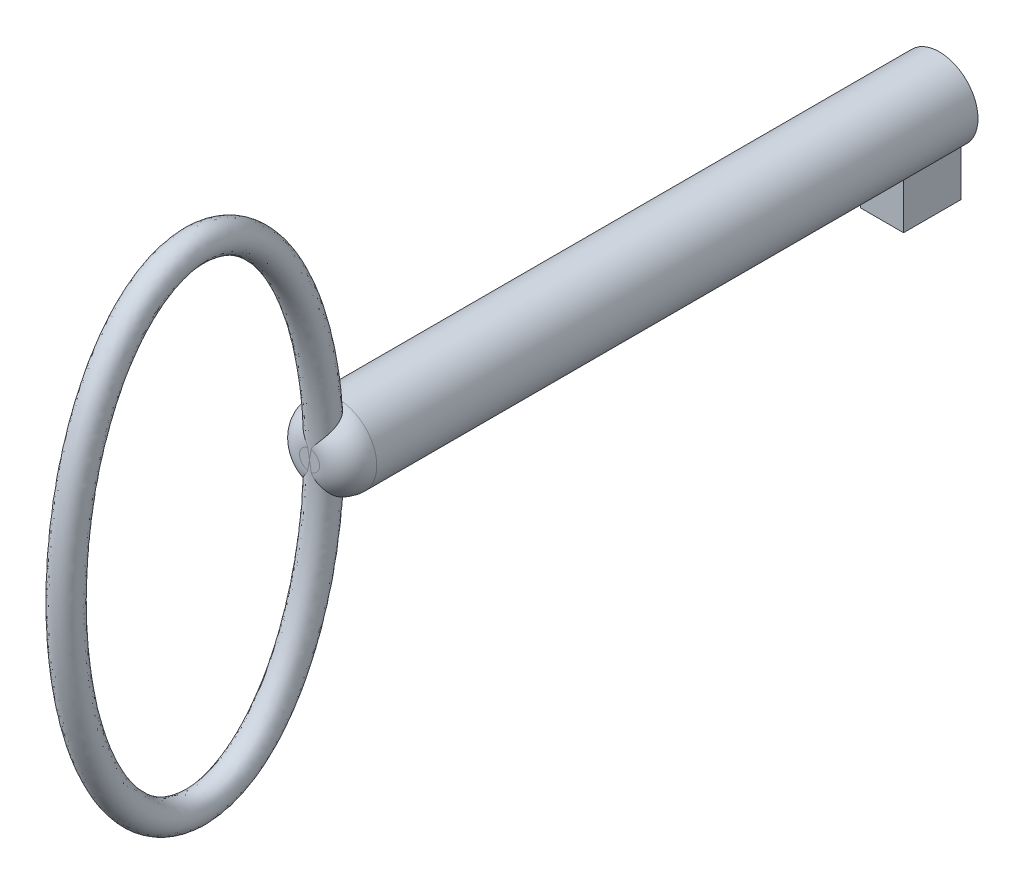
SolidWorks part; units mm, degrees
ref_plane "Front Plane" through (0, 0, 0) normal (0, 0, 1) x (1, 0, 0)
ref_plane "Top Plane" through (0, 0, 0) normal (0, 1, 0) x (1, 0, 0)
ref_plane "Right Plane" through (0, 0, 0) normal (1, 0, 0) x (0, 0, -1)
sketch "Sketch1" plane through (0, 0, 0) normal (0, 0, 1) x (1, 0, 0)
  line L0 (0, 0) -> (0, 12.8907) construction
  line L2 (1.5875, -1.9828) -> (1.5875, -4.7625)
  line L3 (1.5875, -4.7625) -> (-1.5875, -4.7625)
  line L4 (-1.5875, -1.9828) -> (-1.5875, -4.7625)
  arc A0 (1.5875, -1.9828) -> (-1.5875, -1.9828) centre (0, 0) ccw
  point P11 (0, -4.7625)
  dimension "D1" = 2.54
  dimension "D3" = 3.175
  dimension "D4" = 4.7625
sketch "Sketch2" plane through (0, 0, 0) normal (0, 0, 1) x (1, 0, 0)
  line L6 (1.1906, -4.3656) -> (1.1906, -1.782)
  line L7 (-1.1906, -4.3656) -> (1.1906, -4.3656)
  line L8 (-1.1906, -1.782) -> (-1.1906, -4.3656)
  line L9 (1.1906, -4.3656) -> (1.1906, -1.782)
  line L10 (-1.1906, -4.3656) -> (1.1906, -4.3656)
  line L11 (-1.1906, -1.782) -> (-1.1906, -4.3656)
  arc A2 (1.1906, -1.782) -> (-1.1906, -1.782) centre (0, 0) ccw
  arc A3 (1.1906, -1.782) -> (-1.1906, -1.782) centre (0, 0) ccw
  dimension "D1" = 0.3969
extrude "Extrude1" add sketch "Sketch2" along normal blind 3.175
sketch "Sketch3" plane through (0, 0, 3.175) normal (0, 0, 1) x (1, 0, 0)
  circle A0 centre (0, 0) radius 2.1431
  arc A1 (1.1906, -1.782) -> (-1.1906, -1.782) centre (0, 0) ccw construction
extrude "Extrude2" add sketch "Sketch3" along normal blind 31.75
sketch "Sketch4" plane through (0, 0, 0) normal (1, 0, 0) x (0, 0, -1)
  line L0 (-3.175, 0) -> (0, 0) construction
  line L1 (-34.925, 2.1431) -> (-34.925, -2.1431) construction
  ellipse E0 centre (-41.275, 0) end of major axis (-41.275, 12.7) minor radius 6.35
  dimension "D1" = 25.4
  dimension "D2" = 12.7
fillet "Fillet4" radius 1.5875 1 edges at (2.1431, 0, 34.925)
sketch "Sketch5" plane through (0, 0, 0) normal (0, 1, 0) x (1, 0, 0)
  line L2 (0, -33.3375) -> (0, 0) construction
  circle A0 centre (0, -34.1312) radius 0.7937
  dimension "D1" = 1.5875
sweep "Sweep1" add profiles "Sketch5" path "Sketch4"
sketch "Sketch6" plane through (0, 0, 0) normal (0, 0, -1) x (-1, 0, 0)
  circle A0 centre (0, 0) radius 0.7937
  dimension "D1" = 1.5875
extrude "Extrude4" cut sketch "Sketch6" against normal blind 6.35
